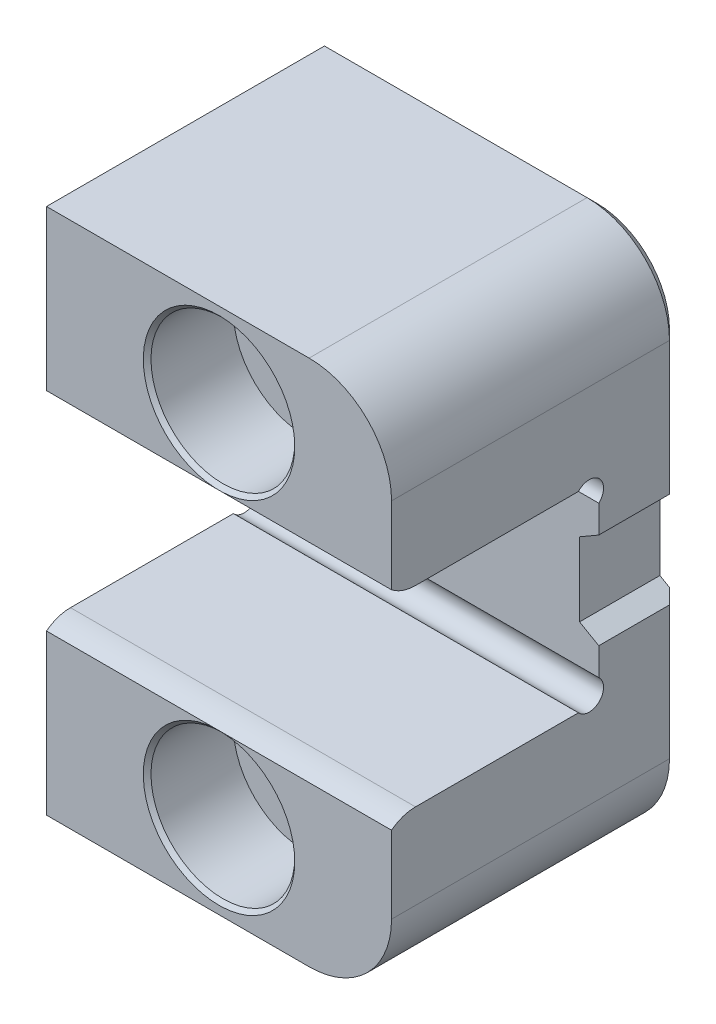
SolidWorks part; units mm, degrees
ref_plane "Front Plane" through (0, 0, 0) normal (0, 0, 1) x (1, 0, 0)
ref_plane "Top Plane" through (0, 0, 0) normal (0, 1, 0) x (1, 0, 0)
ref_plane "Right Plane" through (0, 0, 0) normal (1, 0, 0) x (0, 0, -1)
sketch "Sketch1" plane through (0, 0, 0) normal (1, 0, 0) x (0, 0, -1)
  line L0 (0, 0) -> (50000, 0) construction
  line L1 (0, 10) -> (21.62, 10)
  line L2 (0, 27.5) -> (30, 27.5)
  line L3 (0, 27.5) -> (0, 10)
  line L4 (0, -27.5) -> (30, -27.5)
  line L5 (30, 27.5) -> (30, -27.5)
  line L6 (21.62, 10) -> (21.62, -10)
  line L7 (21.62, -10) -> (0, -10)
  line L9 (0, 19.8) -> (0, -19.8) construction
  line L10 (0, -10) -> (0, -27.5)
  dimension "D1" = 30
  dimension "D2" = 55
  dimension "D3" = 21.62
  dimension "D4" = 20
extrude "Extrude1" add sketch "Sketch1" along normal mid plane 36
fillet "Fillet1" radius 8.6 2 edges at (18, -27.5, -15) (18, 27.5, -15)
sketch "Sketch2" plane through (-12, 0, 0) normal (0, 0, 1) x (1, 0, 0)
  line L0 (0, 0) -> (50000, 0) construction
  line L1 (30, 10) -> (30, -10) construction
  line L6 (30, -5) -> (28, -3.8453)
  line L10 (28, -3.8453) -> (28, 3.8453)
  line L11 (30, 5) -> (28, 3.8453)
  line L12 (30, -5) -> (30, 5)
  dimension "D1" = 10
  dimension "D2" = 2
  dimension "D3" = 30
extrude "Cut-Extrude1" cut sketch "Sketch2" against normal through all
sketch "Sketch5" plane through (18, 0, 0) normal (1, 0, 0) x (0, 0, -1)
  line L0 (0, 0) -> (50000, 0) construction
  line L1 (0, 10) -> (21.62, 10) construction
  line L2 (0, 18.9) -> (0, 10) construction
  line L3 (0, -10) -> (0, -18.9) construction
  line L4 (-7.5, -5.859) -> (2.5, -5.859)
  line L5 (-7.5, -5.859) -> (-7.5, -10.859)
  line L6 (-7.5, -10.859) -> (0, -10.859)
  line L7 (2.5, -5.859) -> (2.5, -10)
  line L8 (21.62, -10) -> (0, -10) construction
  line L9 (2.5, 5.859) -> (2.5, 10)
  line L10 (-7.5, 10.859) -> (0, 10.859)
  line L11 (-7.5, 5.859) -> (-7.5, 10.859)
  line L12 (-7.5, 5.859) -> (2.5, 5.859)
  arc A0 (0.3261, -10.3903) -> (2.5, -10) centre (2.5, -16.25) cw construction
  arc A1 (0, -10.859) -> (0.3261, -10.3903) centre (0.5, -10.859) cw construction
  arc A2 (0, 10.859) -> (0.3261, 10.3903) centre (0.5, 10.859) ccw construction
  arc A3 (0.3261, 10.3903) -> (2.5, 10) centre (2.5, 16.25) ccw construction
  arc A4 (0, 10.859) -> (2.5, 10) centre (2.5, 14.0673) ccw
  arc A5 (0, -10.859) -> (2.5, -10) centre (2.5, -14.0673) cw
  dimension "D1" = 0.5
  dimension "D2" = 6.25
  dimension "D3" = 5
  dimension "D4" = 10
  dimension "D5" = 2.5
extrude "Cut-Extrude2" cut sketch "Sketch5" against normal through all
sketch "Sketch6" plane through (18, 0, 0) normal (1, 0, 0) x (0, 0, -1)
  line L0 (0, 0) -> (50000, 0) construction
  line L3 (21.62, 10) -> (21.62, 5) construction
  line L4 (2.5, 10) -> (21.62, 10) construction
  circle A0 centre (20.62, 9) radius 1.5
  circle A1 centre (20.62, -9) radius 1.5
  dimension "D2" = 0.5
  dimension "D3" = 1.5
  dimension "D1" = 0.5
extrude "Cut-Extrude3" cut sketch "Sketch6" against normal through all
hole_wizard "CBORE for M8 SHCS1" positions "Sketch8" profile "Sketch7" counterbore size "M8" standard "Ansi Metric"
sketch "Sketch8" plane through (0, 0, 0) normal (0, 0, 1) x (1, 0, 0)
  line L0 (0, 0) -> (50000, 0) construction
  point P0 (0, 18.75)
  point P5 (0, -18.75)
  dimension "D1" = 37.5
sketch "Sketch7" plane through (0, 18.75, 0) normal (1, 0, 0) x (0, -1, 0)
  line L0 (0, 0) -> (0, 30)
  line L1 (0, 30) -> (4.5, 30)
  line L3 (4.5, 30) -> (4.5, 9)
  line L4 (4.5, 9) -> (7.5, 9)
  line L5 (7.5, 9) -> (7.5, 0)
  line L7 (7.5, 0) -> (0, 0)
  line L11 (0, -6.35) -> (0, 107.95) construction
  dimension "Thru Hole Dia." = 9
  dimension "Thru Hole Depth" = 30
  dimension "C'Bore Dia." = 15
  dimension "C'Bore Depth" = 9
chamfer "Chamfer1" distance 1 angle 45 6 edges at (-4.3, -27.5, -30) (-4.3, 27.5, -30) (15.4811, -24.9811, -30) (18, -11.95, -30) (18, 11.95, -30) (15.4811, 24.9811, -30)
chamfer "Chamfer3" distance 0.4 angle 45 2 edges at (7.5, -18.75, 0) (7.5, 18.75, 0)
